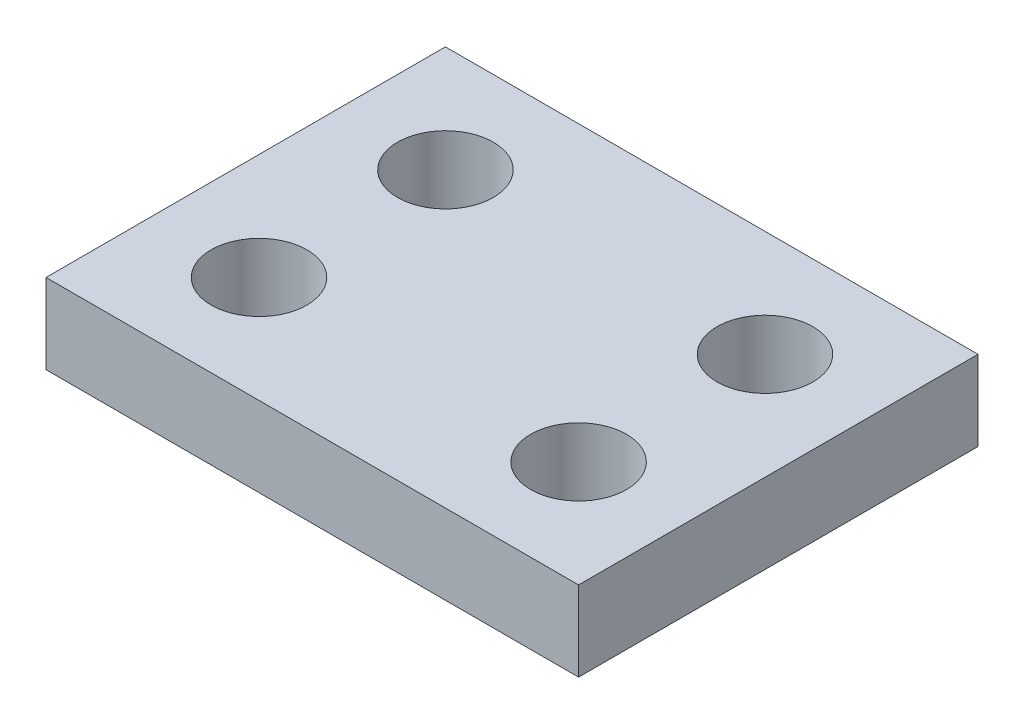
SolidWorks part; units mm, degrees
ref_plane "Front Plane" through (0, 0, 0) normal (0, 0, 1) x (1, 0, 0)
ref_plane "Top Plane" through (0, 0, 0) normal (0, 1, 0) x (1, 0, 0)
ref_plane "Right Plane" through (0, 0, 0) normal (1, 0, 0) x (0, 0, -1)
sketch "Sketch1" plane through (0, 0, 0) normal (0, 1, 0) x (1, 0, 0)
  line L1 (-50, -37.5) -> (50, -37.5)
  line L2 (-50, -37.5) -> (-50, 37.5)
  line L3 (-50, 37.5) -> (50, 37.5)
  line L4 (50, -37.5) -> (50, 37.5)
  line L5 (-50, -37.5) -> (50, 37.5) construction
  line L6 (-50, 37.5) -> (50, -37.5) construction
  point P0 (0, 0)
  dimension "D1" = 100
  dimension "D2" = 75
extrude "Boss-Extrude1" add sketch "Sketch1" along normal blind 15
hole_wizard "M20x2.0 Tapped Hole1" positions "Sketch2" profile "Sketch3" tap size "M20x2.0" standard "ANSI Metric"
sketch "Sketch2" plane through (0, 15, 0) normal (0, 1, 0) x (-1, 0, 0)
  line L0 (50, 37.5) -> (-50, 37.5) construction
  line L1 (-50, -37.5) -> (50, -37.5) construction
  line L2 (-50, 37.5) -> (-50, -37.5) construction
  line L3 (50, -37.5) -> (50, 37.5) construction
  point P0 (30, 17.5)
  point P2 (30, -17.5)
  point P4 (-30, -17.5)
  point P6 (-30, 17.5)
  dimension "D1" = 20
  dimension "D2" = 20
  dimension "D3" = 20
  dimension "D4" = 20
  dimension "D5" = 20
sketch "Sketch3" plane through (-30, 15, 17.5) normal (1, 0, 0) x (0, 0, 1)
  line L0 (0, 0) -> (0, 15)
  line L1 (0, 15) -> (9, 15)
  line L2 (9, 15) -> (9, 0)
  line L5 (9, 0) -> (0, 0)
  line L11 (0, -6.35) -> (0, 107.95) construction
  dimension "Thru Tap Drill Dia." = 18
  dimension "Thru Tap Drill Depth" = 15
